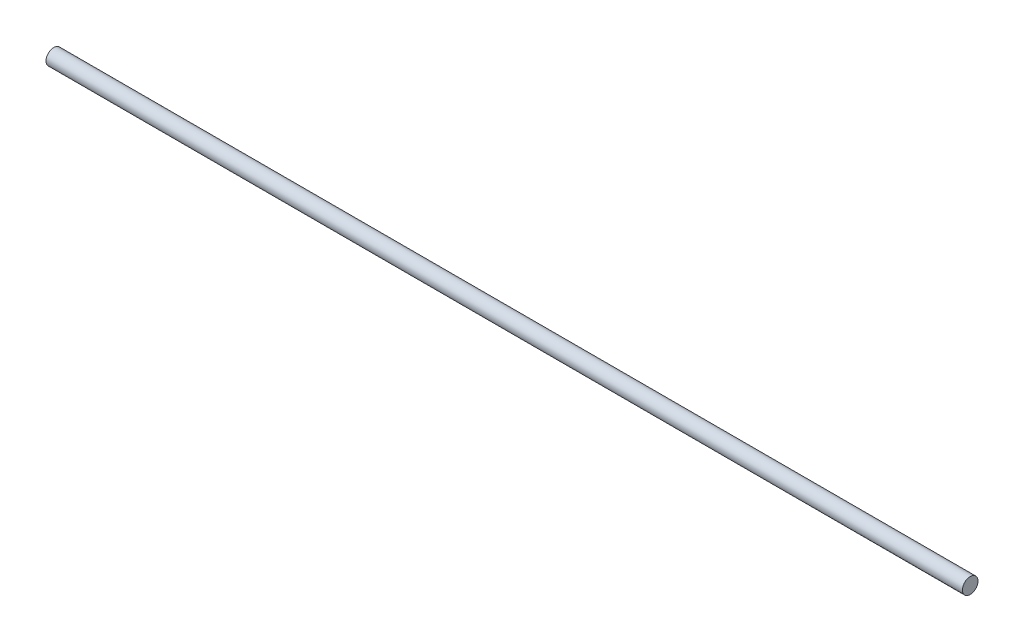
SolidWorks part; units mm, degrees
ref_plane "Ebene vorne" through (0, 0, 0) normal (0, 0, 1) x (1, 0, 0)
ref_plane "Ebene oben" through (0, 0, 0) normal (0, 1, 0) x (1, 0, 0)
ref_plane "Ebene rechts" through (0, 0, 0) normal (1, 0, 0) x (0, 0, -1)
sketch "Skizze1" plane through (0, 0, 0) normal (1, 0, 0) x (0, 0, -1)
  circle A0 centre (0, 0) radius 4
  dimension "D1" = 8
extrude "Aufsatz-Linear austragen1" add sketch "Skizze1" along normal mid plane 470
